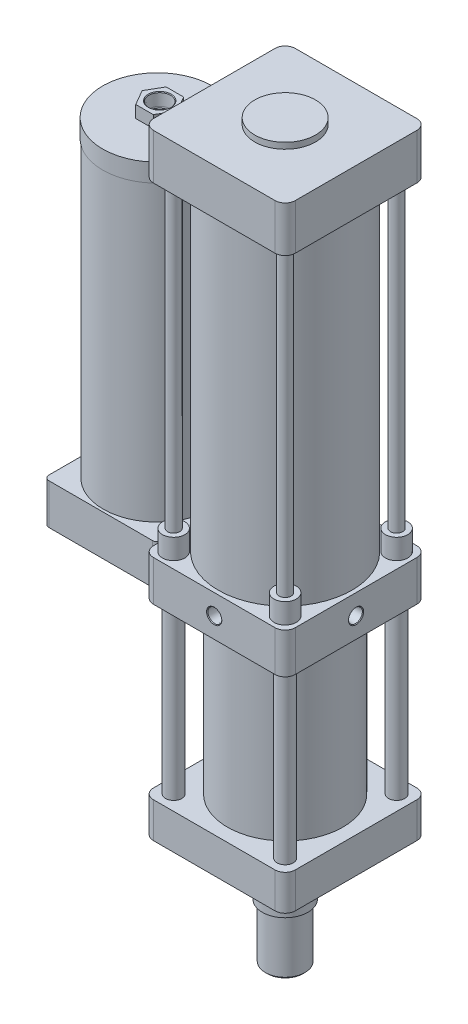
SolidWorks part; units mm, degrees
ref_plane "前视基准面" through (0, 0, 0) normal (0, 0, 1) x (1, 0, 0)
ref_plane "上视基准面" through (0, 0, 0) normal (0, 1, 0) x (1, 0, 0)
ref_plane "右视基准面" through (0, 0, 0) normal (1, 0, 0) x (0, 0, -1)
sketch "草图1" plane through (0, 0, 0) normal (0, 1, 0) x (1, 0, 0)
  line L0 (0, 0) -> (55, 0) construction
  line L1 (60, 70) -> (-60, 70)
  line L2 (70, 60) -> (70, -60)
  line L3 (60, -70) -> (-60, -70)
  line L4 (-70, 60) -> (-70, -60)
  line L5 (70, 70) -> (-70, -70) construction
  line L6 (70, -70) -> (-70, 70) construction
  line L7 (55, 0) -> (55, -55) construction
  circle A0 centre (55, -55) radius 8
  circle A1 centre (-55, -55) radius 8
  circle A2 centre (-55, 55) radius 8
  circle A3 centre (55, 55) radius 8
  arc A4 (-70, -60) -> (-60, -70) centre (-60, -60) ccw
  arc A5 (70, -60) -> (60, -70) centre (60, -60) cw
  arc A6 (60, 70) -> (70, 60) centre (60, 60) cw
  arc A7 (-70, 60) -> (-60, 70) centre (-60, 60) cw
  point P0 (0, 0)
  point P19 (0, 0)
  dimension "D3" = 4
  dimension "D4" = 10
  dimension "D1" = 140
  dimension "D2" = 140
extrude "凸台-拉伸1" add sketch "草图1" along normal blind 35
sketch "草图2" plane through (0, 0, 0) normal (0, -1, 0) x (1, 0, 0)
  circle A0 centre (0, 0) radius 32.5
extrude "凸台-拉伸2" add sketch "草图2" along normal blind 22
sketch "草图3" plane through (0, 35, 0) normal (0, 1, 0) x (1, 0, 0)
  circle A0 centre (0, 0) radius 57
extrude "凸台-拉伸3" add sketch "草图3" along normal blind 167
sketch "草图4" plane through (0, 202, 0) normal (0, 1, 0) x (1, 0, 0)
  line L0 (-60, -70) -> (60, -70) construction
  line L1 (70, -60) -> (70, 60) construction
  line L2 (60, 70) -> (-60, 70) construction
  line L3 (-70, 60) -> (-70, -60) construction
  line L4 (-60, -70) -> (60, -70)
  line L5 (70, -60) -> (70, 60)
  line L6 (60, 70) -> (-60, 70)
  line L7 (-70, 60) -> (-70, -60)
  arc A0 (-70, -60) -> (-60, -70) centre (-60, -60) ccw construction
  arc A1 (60, -70) -> (70, -60) centre (60, -60) ccw construction
  arc A2 (70, 60) -> (60, 70) centre (60, 60) ccw construction
  arc A3 (-60, 70) -> (-70, 60) centre (-60, 60) ccw construction
  arc A4 (-70, -60) -> (-60, -70) centre (-60, -60) ccw
  arc A5 (60, -70) -> (70, -60) centre (60, -60) ccw
  arc A6 (70, 60) -> (60, 70) centre (60, 60) ccw
  arc A7 (-60, 70) -> (-70, 60) centre (-60, 60) ccw
  circle A8 centre (-55, -55) radius 8 construction
  circle A9 centre (55, -55) radius 8 construction
  circle A10 centre (55, 55) radius 8 construction
  circle A11 centre (-55, 55) radius 8 construction
  circle A12 centre (-55, -55) radius 8
  circle A13 centre (55, -55) radius 8
  circle A14 centre (55, 55) radius 8
  circle A15 centre (-55, 55) radius 8
extrude "凸台-拉伸4" add sketch "草图4" along normal blind 40
sketch "草图5" plane through (0, 242, 0) normal (0, 1, 0) x (1, 0, 0)
  circle A0 centre (-55, 55) radius 11
  circle A1 centre (55, 55) radius 11
  circle A2 centre (-55, -55) radius 11
  circle A3 centre (55, -55) radius 11
extrude "凸台-拉伸5" add sketch "草图5" along normal blind 20
sketch "草图6" plane through (0, 242, 0) normal (0, 1, 0) x (1, 0, 0)
  circle A0 centre (0, 0) radius 66
extrude "凸台-拉伸6" add sketch "草图6" along normal blind 320
sketch "草图7" plane through (0, 562, 0) normal (0, 1, 0) x (1, 0, 0)
  line L0 (-60, -70) -> (60, -70) construction
  line L1 (70, -60) -> (70, 60) construction
  line L2 (-70, 60) -> (-70, -60) construction
  line L3 (60, 70) -> (-60, 70) construction
  line L4 (-60, -70) -> (60, -70)
  line L5 (70, -60) -> (70, 60)
  line L6 (-70, 60) -> (-70, -60)
  line L7 (60, 70) -> (-60, 70)
  arc A0 (-70, -60) -> (-60, -70) centre (-60, -60) ccw construction
  arc A1 (60, -70) -> (70, -60) centre (60, -60) ccw construction
  arc A2 (70, 60) -> (60, 70) centre (60, 60) ccw construction
  arc A3 (-60, 70) -> (-70, 60) centre (-60, 60) ccw construction
  arc A4 (-70, -60) -> (-60, -70) centre (-60, -60) ccw
  arc A5 (60, -70) -> (70, -60) centre (60, -60) ccw
  arc A6 (70, 60) -> (60, 70) centre (60, 60) ccw
  arc A7 (-60, 70) -> (-70, 60) centre (-60, 60) ccw
extrude "凸台-拉伸7" add sketch "草图7" along normal blind 45
sketch "草图8" plane through (0, 607, 0) normal (0, 1, 0) x (1, 0, 0)
  circle A0 centre (0, 0) radius 30
extrude "凸台-拉伸8" add sketch "草图8" along normal blind 6
sketch "草图9" plane through (0, 262, 0) normal (0, 1, 0) x (1, 0, 0)
  circle A0 centre (-55, 55) radius 6
  circle A1 centre (-55, -55) radius 6
  circle A2 centre (55, -55) radius 6
  circle A3 centre (55, 55) radius 6
extrude "凸台-拉伸9" add sketch "草图9" along normal up to surface (300 mm away)
sketch "草图10" plane through (0, 0, 0) normal (0, -1, 0) x (1, 0, 0)
  circle A0 centre (55, -55) radius 8 construction
  circle A1 centre (55, 55) radius 8 construction
  circle A2 centre (-55, 55) radius 8 construction
  circle A3 centre (-55, -55) radius 8 construction
  circle A4 centre (55, -55) radius 8
  circle A5 centre (55, 55) radius 8
  circle A6 centre (-55, 55) radius 8
  circle A7 centre (-55, -55) radius 8
extrude "凸台-拉伸10" add sketch "草图10" against normal up to surface (202 mm away) separate body
sketch "草图11" plane through (0, 202, 0) normal (0, -1, 0) x (1, 0, 0)
  line L0 (-70, 0) -> (-126, 0) construction
  line L1 (-70, -60) -> (-70, 60) construction
  line L3 (-177, 56) -> (-75, 56)
  line L4 (-182, 51) -> (-182, -51)
  line L5 (-177, -56) -> (-75, -56)
  line L6 (-70, 51) -> (-70, -51)
  line L7 (-182, 56) -> (-70, -56) construction
  line L8 (-182, -56) -> (-70, 56) construction
  arc A0 (-75, -56) -> (-70, -51) centre (-75, -51) ccw
  arc A1 (-75, 56) -> (-70, 51) centre (-75, 51) cw
  arc A2 (-182, 51) -> (-177, 56) centre (-177, 51) cw
  arc A3 (-177, -56) -> (-182, -51) centre (-177, -51) cw
  dimension "D3" = 5
  dimension "D1" = 112
  dimension "D2" = 112
extrude "凸台-拉伸11" add sketch "草图11" against normal up to surface (40 mm away) separate body
sketch "草图12" plane through (0, 242, 0) normal (0, 1, 0) x (1, 0, 0)
  line L0 (-126, -56) -> (-126, 56) construction
  line L1 (-75, -56) -> (-177, -56) construction
  circle A0 centre (-126, 0) radius 53.5
extrude "凸台-拉伸12" add sketch "草图12" along normal blind 290 separate body
sketch "草图13" plane through (0, 532, 0) normal (0, 1, 0) x (1, 0, 0)
  circle A0 centre (-126, 0) radius 54
extrude "凸台-拉伸13" add sketch "草图13" along normal blind 18 separate body
sketch "草图14" plane through (0, 550, 0) normal (0, 1, 0) x (1, 0, 0)
  line L1 (-144.4652, 3.3687) -> (-135.805, -11.6313)
  line L2 (-135.805, -11.6313) -> (-118.4845, -11.6313)
  line L3 (-118.4845, -11.6313) -> (-109.8242, 3.3687)
  line L4 (-109.8242, 3.3687) -> (-118.4845, 18.3687)
  line L5 (-118.4845, 18.3687) -> (-135.805, 18.3687)
  line L6 (-135.805, 18.3687) -> (-144.4652, 3.3687)
  circle A0 centre (-127.1447, 3.3687) radius 15 construction
extrude "凸台-拉伸14" add sketch "草图14" along normal blind 12 separate body
hole_wizard "1/2 NPT 螺纹孔1" positions "草图15" profile "草图16" size "1/2" standard "ANSI Inch"
sketch "草图15" plane through (0, 562, 0) normal (0, 1, 0) x (1, 0, 0)
  line L0 (-118.4845, 18.3687) -> (-135.805, 18.3687) construction
  line L1 (-144.4652, 3.3687) -> (-135.805, -11.6313) construction
  point P0 (-127.1447, 3.3687)
  dimension "D1" = 15
  dimension "D2" = 15
sketch "草图16" plane through (-127.1447, 562, -3.3687) normal (1, 0, 0) x (0, 0, 1)
  line L0 (0, 0) -> (0, 28.0045)
  line L1 (8.9281, 22.64) -> (0, 28.0045)
  line L2 (-8.9281, 22.64) -> (0, 28.0045) construction
  line L3 (8.9281, 22.64) -> (8.9281, 13.57)
  line L4 (8.9281, 13.57) -> (10.2807, 13.57)
  line L5 (10.2807, 13.57) -> (10.668, 0.635)
  line L6 (10.668, 0.635) -> (11.303, 0)
  line L7 (11.303, 0) -> (0, 0)
  line L8 (0, -6.35) -> (0, 107.95) construction
  line L9 (-10.668, 0.635) -> (-11.303, 0) construction
  line L11 (-8.9281, 13.57) -> (-10.2807, 13.57) construction
  line L12 (-10.2807, 13.57) -> (-10.668, 0.635) construction
  dimension "螺纹孔钻头直径" = 17.8562
  dimension "螺纹孔钻头深度" = 22.64
  dimension "螺纹直径" = 21.3359
  dimension "螺纹角度" = 3.43
  dimension "螺纹深度" = 13.57
  dimension "锥形沉头孔直径" = 22.6059
  dimension "锥形沉头孔角度" = 90
  dimension "导头角度" = 118
hole_wizard "1/4 NPT 螺纹孔1" positions "草图19" profile "草图20" size "1/4" standard "ANSI Inch"
sketch "草图19" plane through (0, 0, 70) normal (0, 0, 1) x (1, 0, 0)
  line L0 (-60, 242) -> (60, 242) construction
  point P0 (0, 222)
  dimension "D1" = 20
sketch "草图20" plane through (0, 222, 70) normal (1, 0, 0) x (0, -1, 0)
  line L0 (0, 0) -> (0, 20.4123)
  line L1 (5.5626, 17.07) -> (0, 20.4123)
  line L2 (-5.5626, 17.07) -> (0, 20.4123) construction
  line L3 (5.5626, 17.07) -> (5.5626, 10.02)
  line L4 (5.5626, 10.02) -> (6.577, 10.02)
  line L5 (6.577, 10.02) -> (6.858, 0.635)
  line L6 (6.858, 0.635) -> (7.493, 0)
  line L7 (7.493, 0) -> (0, 0)
  line L8 (0, -6.35) -> (0, 107.95) construction
  line L9 (-6.858, 0.635) -> (-7.493, 0) construction
  line L11 (-5.5626, 10.02) -> (-6.577, 10.02) construction
  line L12 (-6.577, 10.02) -> (-6.858, 0.635) construction
  dimension "螺纹孔钻头直径" = 11.1252
  dimension "螺纹孔钻头深度" = 17.07
  dimension "螺纹直径" = 13.716
  dimension "螺纹角度" = 3.43
  dimension "螺纹深度" = 10.02
  dimension "锥形沉头孔直径" = 14.986
  dimension "锥形沉头孔角度" = 90
  dimension "导头角度" = 118
hole_wizard "1/4 NPT 螺纹孔2" positions "草图21" profile "草图22" size "1/4" standard "ANSI Inch"
sketch "草图21" plane through (70, 0, 0) normal (1, 0, 0) x (0, 0, -1)
  line L0 (-60, 202) -> (60, 202) construction
  point P0 (0, 222)
  dimension "D1" = 20
sketch "草图22" plane through (70, 222, 0) normal (0, 1, 0) x (0, 0, -1)
  line L0 (0, 0) -> (0, 20.4123)
  line L1 (5.5626, 17.07) -> (0, 20.4123)
  line L2 (-5.5626, 17.07) -> (0, 20.4123) construction
  line L3 (5.5626, 17.07) -> (5.5626, 10.02)
  line L4 (5.5626, 10.02) -> (6.577, 10.02)
  line L5 (6.577, 10.02) -> (6.858, 0.635)
  line L6 (6.858, 0.635) -> (7.493, 0)
  line L7 (7.493, 0) -> (0, 0)
  line L8 (0, -6.35) -> (0, 107.95) construction
  line L9 (-6.858, 0.635) -> (-7.493, 0) construction
  line L11 (-5.5626, 10.02) -> (-6.577, 10.02) construction
  line L12 (-6.577, 10.02) -> (-6.858, 0.635) construction
  dimension "螺纹孔钻头直径" = 11.1252
  dimension "螺纹孔钻头深度" = 17.07
  dimension "螺纹直径" = 13.716
  dimension "螺纹角度" = 3.43
  dimension "螺纹深度" = 10.02
  dimension "锥形沉头孔直径" = 14.986
  dimension "锥形沉头孔角度" = 90
  dimension "导头角度" = 118
sketch "草图23" plane through (0, -22, 0) normal (0, -1, 0) x (1, 0, 0)
  circle A0 centre (0, 0) radius 22.5
extrude "凸台-拉伸15" add sketch "草图23" along normal blind 33
sketch "草图24" plane through (0, -55, 0) normal (0, -1, 0) x (1, 0, 0)
  circle A0 centre (0, 0) radius 19.5
extrude "凸台-拉伸16" add sketch "草图24" along normal blind 55
chamfer "倒角2" distance 2 angle 45 1 edges at (0, -110, -19.5)
hole_wizard "1/2 NPT 螺纹孔3" positions "草图25" profile "草图26" size "1/2" standard "ANSI Inch"
sketch "草图25" plane through (-70, 0, 0) normal (-1, 0, 0) x (0, 0, 1)
  line L0 (-60, 35) -> (60, 35) construction
  point P0 (0, 17.5)
  dimension "D1" = 17.5
sketch "草图26" plane through (-70, 17.5, 0) normal (0, 1, 0) x (0, 0, 1)
  line L0 (0, 0) -> (0, 28.0045)
  line L1 (8.9281, 22.64) -> (0, 28.0045)
  line L2 (-8.9281, 22.64) -> (0, 28.0045) construction
  line L3 (8.9281, 22.64) -> (8.9281, 13.57)
  line L4 (8.9281, 13.57) -> (10.2807, 13.57)
  line L5 (10.2807, 13.57) -> (10.668, 0.635)
  line L6 (10.668, 0.635) -> (11.303, 0)
  line L7 (11.303, 0) -> (0, 0)
  line L8 (0, -6.35) -> (0, 107.95) construction
  line L9 (-10.668, 0.635) -> (-11.303, 0) construction
  line L11 (-8.9281, 13.57) -> (-10.2807, 13.57) construction
  line L12 (-10.2807, 13.57) -> (-10.668, 0.635) construction
  dimension "螺纹孔钻头直径" = 17.8562
  dimension "螺纹孔钻头深度" = 22.64
  dimension "螺纹直径" = 21.3359
  dimension "螺纹角度" = 3.43
  dimension "螺纹深度" = 13.57
  dimension "锥形沉头孔直径" = 22.6059
  dimension "锥形沉头孔角度" = 90
  dimension "导头角度" = 118
hole_wizard "1/2 NPT 螺纹孔4" positions "草图27" profile "草图28" size "1/2" standard "ANSI Inch"
sketch "草图27" plane through (0, 0, -70) normal (0, 0, -1) x (-1, 0, 0)
  line L0 (-60, 242) -> (60, 242) construction
  line L1 (-60, 607) -> (60, 607) construction
  point P0 (0, 222)
  point P2 (0, 584.5)
  dimension "D1" = 20
  dimension "D2" = 22.5
sketch "草图28" plane through (0, 222, -70) normal (1, 0, 0) x (0, 1, 0)
  line L0 (0, 0) -> (0, 28.0045)
  line L1 (8.9281, 22.64) -> (0, 28.0045)
  line L2 (-8.9281, 22.64) -> (0, 28.0045) construction
  line L3 (8.9281, 22.64) -> (8.9281, 13.57)
  line L4 (8.9281, 13.57) -> (10.2807, 13.57)
  line L5 (10.2807, 13.57) -> (10.668, 0.635)
  line L6 (10.668, 0.635) -> (11.303, 0)
  line L7 (11.303, 0) -> (0, 0)
  line L8 (0, -6.35) -> (0, 107.95) construction
  line L9 (-10.668, 0.635) -> (-11.303, 0) construction
  line L11 (-8.9281, 13.57) -> (-10.2807, 13.57) construction
  line L12 (-10.2807, 13.57) -> (-10.668, 0.635) construction
  dimension "螺纹孔钻头直径" = 17.8562
  dimension "螺纹孔钻头深度" = 22.64
  dimension "螺纹直径" = 21.3359
  dimension "螺纹角度" = 3.43
  dimension "螺纹深度" = 13.57
  dimension "锥形沉头孔直径" = 22.6059
  dimension "锥形沉头孔角度" = 90
  dimension "导头角度" = 118
